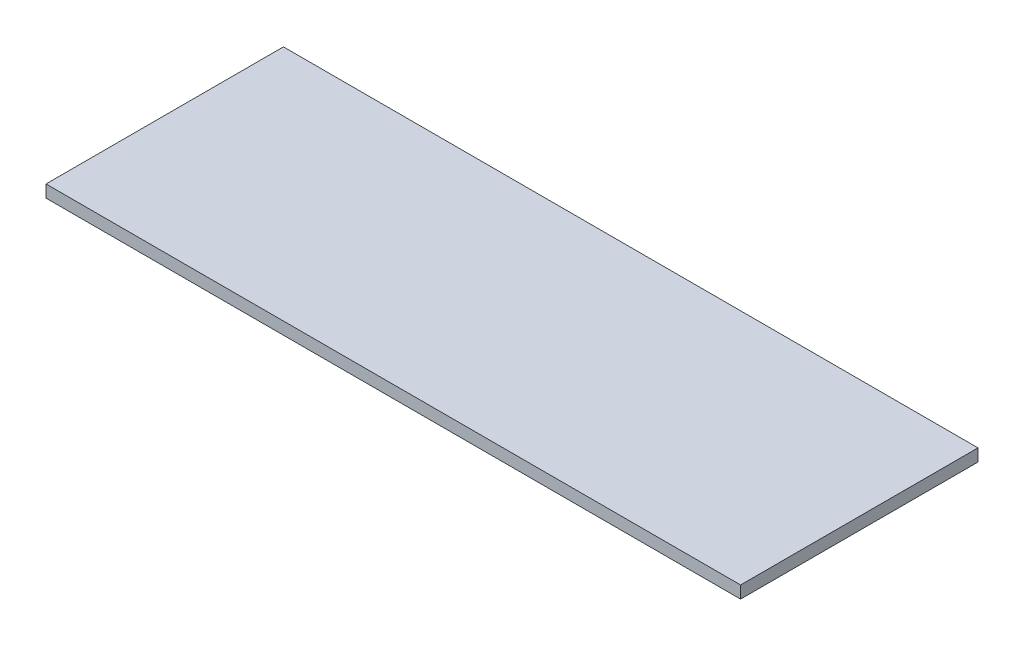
SolidWorks part; units mm, degrees
ref_plane "Front Plane" through (0, 0, 0) normal (0, 0, 1) x (1, 0, 0)
ref_plane "Top Plane" through (0, 0, 0) normal (0, 1, 0) x (1, 0, 0)
ref_plane "Right Plane" through (0, 0, 0) normal (1, 0, 0) x (0, 0, -1)
sketch "Sketch1" plane through (0, 0, 0) normal (0, 1, 0) x (1, 0, 0)
  line L1 (-82.55, 28.2194) -> (82.55, 28.2194)
  line L2 (-82.55, 28.2194) -> (-82.55, -28.2194)
  line L3 (-82.55, -28.2194) -> (82.55, -28.2194)
  line L4 (82.55, 28.2194) -> (82.55, -28.2194)
  line L5 (-82.55, 28.2194) -> (82.55, -28.2194) construction
  line L6 (-82.55, -28.2194) -> (82.55, 28.2194) construction
  point P0 (0, 0)
  dimension "D1" = 56.4388
  dimension "D2" = 165.1
extrude "Boss-Extrude1" add sketch "Sketch1" along normal blind 2.921
equation "\"thickness_acrylic0.1\"=0.1in"
equation "\"motor offset\"=6mm"
equation "\"thickness0.25\"=0.225in"
equation "\"thickness0.125\"=0.122in"
